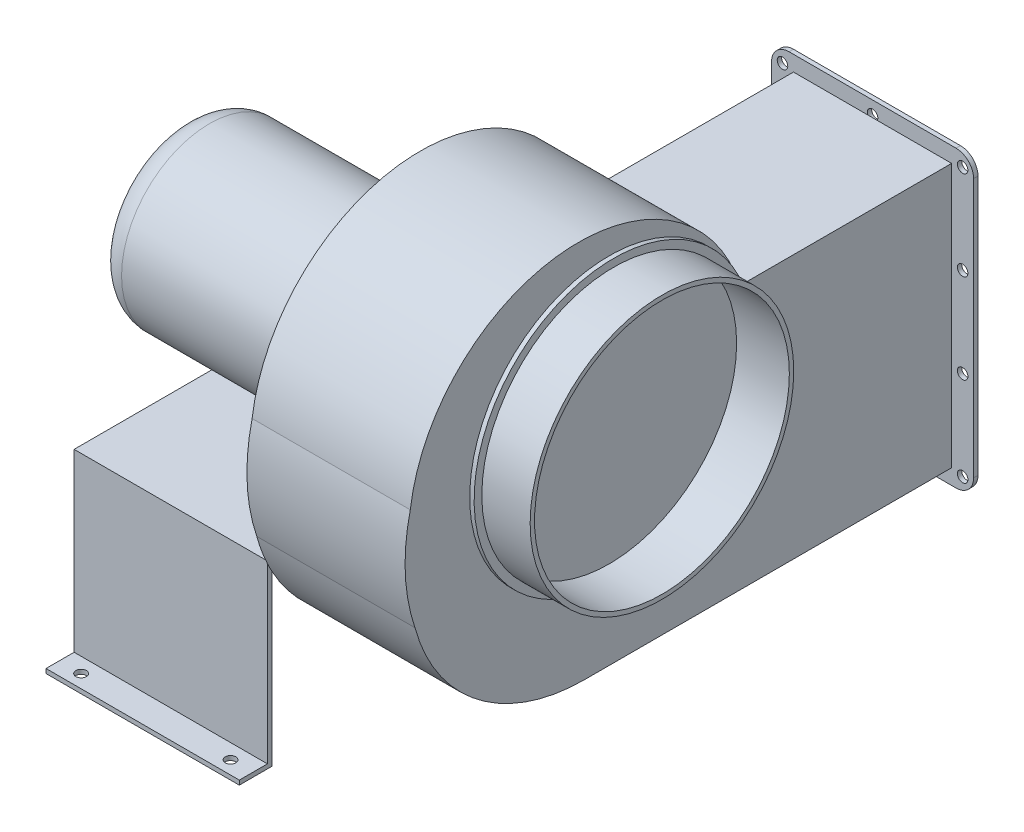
SolidWorks part; units mm, degrees
ref_plane "前视基准面" through (0, 0, 0) normal (0, 0, 1) x (1, 0, 0)
ref_plane "上视基准面" through (0, 0, 0) normal (0, 1, 0) x (1, 0, 0)
ref_plane "右视基准面" through (0, 0, 0) normal (1, 0, 0) x (0, 0, -1)
sketch "草图1" plane through (0, 0, 0) normal (1, 0, 0) x (0, 0, -1)
  line L0 (311.5, -259) -> (311.5, 41)
  line L1 (-83.5, -259) -> (311.5, -259)
  line L4 (311.5, 41) -> (65.5, 41)
  line L10 (65.5, 41) -> (65.4538, 41)
  arc A2 (65.4538, 41) -> (-308.9244, -49.1196) centre (-118.5, -17.5) ccw
  arc A3 (-308.9244, -49.1196) -> (-83.5, -259) centre (-83.5, -33) ccw
  point P0 (0, 0)
extrude "凸台-拉伸1" add sketch "草图1" along normal blind 180
sketch "草图2" plane through (180, 0, 0) normal (1, 0, 0) x (0, 0, -1)
  circle A0 centre (-83.5, -14) radius 150
  circle A1 centre (-83.5, -14) radius 145
extrude "凸台-拉伸2" add sketch "草图2" along normal blind 60
sketch "草图3" plane through (180, 0, 0) normal (1, 0, 0) x (0, 0, -1)
  circle A0 centre (-83.5, -14) radius 158.7836
  circle A1 centre (-83.5, -14) radius 150
extrude "凸台-拉伸3" add sketch "草图3" along normal blind 5
sketch "草图4" plane through (0, 0, -311.5) normal (0, 0, -1) x (-1, 0, 0)
  line L1 (-185, -276.5) -> (5, -276.5)
  line L2 (-205, -256.5) -> (-205, 38.5)
  line L3 (-185, 58.5) -> (5, 58.5)
  line L4 (25, -256.5) -> (25, 38.5)
  line L5 (-205, -276.5) -> (25, 58.5) construction
  line L6 (-205, 58.5) -> (25, -276.5) construction
  arc A0 (5, -276.5) -> (25, -256.5) centre (5, -256.5) ccw
  arc A1 (-185, -276.5) -> (-205, -256.5) centre (-185, -256.5) cw
  arc A2 (-205, 38.5) -> (-185, 58.5) centre (-185, 38.5) cw
  arc A3 (5, 58.5) -> (25, 38.5) centre (5, 38.5) cw
  point P0 (-90, -109)
  dimension "D1" = 20
extrude "切除-拉伸1" cut sketch "草图4" against normal blind 5.3
sketch "草图6" plane through (0, 0, -306.2) normal (0, 0, -1) x (-1, 0, 0)
  line L1 (-185, -276.5) -> (5, -276.5)
  line L2 (-205, -256.5) -> (-205, 38.5)
  line L3 (-185, 58.5) -> (5, 58.5)
  line L4 (25, -256.5) -> (25, 38.5)
  line L5 (-205, -276.5) -> (25, 58.5) construction
  line L6 (-205, 58.5) -> (25, -276.5) construction
  arc A0 (5, -276.5) -> (25, -256.5) centre (5, -256.5) ccw
  arc A1 (-185, -276.5) -> (-205, -256.5) centre (-185, -256.5) cw
  arc A2 (-205, 38.5) -> (-185, 58.5) centre (-185, 38.5) cw
  arc A3 (5, 58.5) -> (25, 38.5) centre (5, 38.5) cw
  point P0 (-90, -109)
  dimension "D1" = 20
extrude "凸台-拉伸4" add sketch "草图6" along normal blind 5
sketch "草图7" plane through (0, 0, -311.2) normal (0, 0, -1) x (-1, 0, 0)
  line L1 (-179, -250.5) -> (-1, -250.5)
  line L2 (-179, -250.5) -> (-179, 32.5)
  line L3 (-179, 32.5) -> (-1, 32.5)
  line L4 (-1, -250.5) -> (-1, 32.5)
  line L5 (-179, -250.5) -> (-1, 32.5) construction
  line L6 (-179, 32.5) -> (-1, -250.5) construction
  point P0 (-90, -109)
extrude "切除-拉伸4" cut sketch "草图7" against normal blind 350
sketch "草图8" plane through (0, 0, -311.2) normal (0, 0, -1) x (-1, 0, 0)
  circle A0 centre (-192.5, 43.5) radius 6
  circle A1 centre (12.5, 43.5) radius 6
  circle A2 centre (12.5, -261.5) radius 6
  circle A3 centre (-192.5, -261.5) radius 6
  circle A4 centre (-192.5, -58.1) radius 6
  circle A5 centre (-192.5, -159.9) radius 6
  circle A6 centre (12.5, -159.9) radius 6
  circle A7 centre (12.5, -58.1) radius 6
  circle A8 centre (-90, 43.5) radius 6
  circle A9 centre (-90, -261.5) radius 6
  point P0 (-90, -109)
extrude "切除-拉伸8" cut sketch "草图8" against normal blind 5
sketch "草图9" plane through (0, 0, 0) normal (-1, 0, 0) x (0, 0, 1)
  circle A0 centre (118.5, -17.5) radius 100
extrude "凸台-拉伸5" add sketch "草图9" along normal blind 270
fillet "圆角1" radius 30 1 edges at (-270, -17.5, 218.5)
sketch "草图11" plane through (0, 0, 0) normal (-1, 0, 0) x (0, 0, 1)
  line L0 (-55.5, -141.5) -> (292.5, -141.5)
  line L1 (-87.5, -346.5) -> (-50.5, -346.5)
  line L2 (287.5, -346.5) -> (292.5, -346.5)
  line L4 (-55.5, -341.5) -> (-55.5, -141.5)
  line L5 (-87.5, -346.5) -> (-87.5, -341.5)
  line L6 (292.5, -341.5) -> (292.5, -141.5)
  line L7 (287.5, -146.5) -> (-50.5, -146.5)
  line L8 (-50.5, -146.5) -> (-50.5, -346.5)
  line L9 (287.5, -146.5) -> (287.5, -346.5)
  line L10 (-87.5, -341.5) -> (-55.5, -341.5)
  line L12 (292.5, -341.5) -> (324.5, -341.5)
  line L13 (324.5, -341.5) -> (324.5, -346.5)
  line L14 (324.5, -346.5) -> (292.5, -346.5)
extrude "凸台-拉伸9" add sketch "草图11" along normal blind 220
sketch "草图15" plane through (0, -341.5, 0) normal (0, 1, 0) x (1, 0, 0)
  circle A0 centre (-195, 72.5) radius 6
  circle A1 centre (-25, 72.5) radius 6
  circle A2 centre (-195, -309.5) radius 6
  circle A3 centre (-25, -309.5) radius 6
extrude "切除-拉伸9" cut sketch "草图15" against normal blind 5
sketch "草图16" plane through (0, 0, 0) normal (-1, 0, 0) x (0, 0, 1)
  line L0 (83.5, -259) -> (111.5317, -259)
  line L1 (311.5317, -17.5) -> (311.5317, -59)
  arc A0 (308.9244, -49.1196) -> (-65.4538, 41) centre (118.5, -17.5) ccw construction
  arc A1 (311.5317, -59) -> (111.5317, -259) centre (111.5317, -59) cw
  arc A2 (83.5, -259) -> (308.9244, -49.1196) centre (83.5, -33) ccw
  arc A3 (308.9244, -49.1196) -> (311.5317, -17.5) centre (118.5, -17.5) ccw
  dimension "D1" = 200
extrude "凸台-拉伸12" add sketch "草图16" against normal blind 180
sketch "草图18" plane through (0, 0, 0) normal (-1, 0, 0) x (0, 0, 1)
  line L0 (309.5587, 8.9463) -> (311.5317, -17.5)
  line L2 (311.5317, -17.5) -> (311.5317, -59)
  line L3 (311.5317, -59) -> (309.5587, -87.0233)
  line L4 (309.5587, -87.0233) -> (304.562, -111.3383)
  arc A0 (292.5, -144.1498) -> (311.5317, -59) centre (111.5317, -59) ccw construction
  arc A1 (304.562, -111.3383) -> (309.5587, 8.9463) centre (101.0931, -42.64) ccw
extrude "凸台-拉伸13" add sketch "草图18" against normal blind 180
